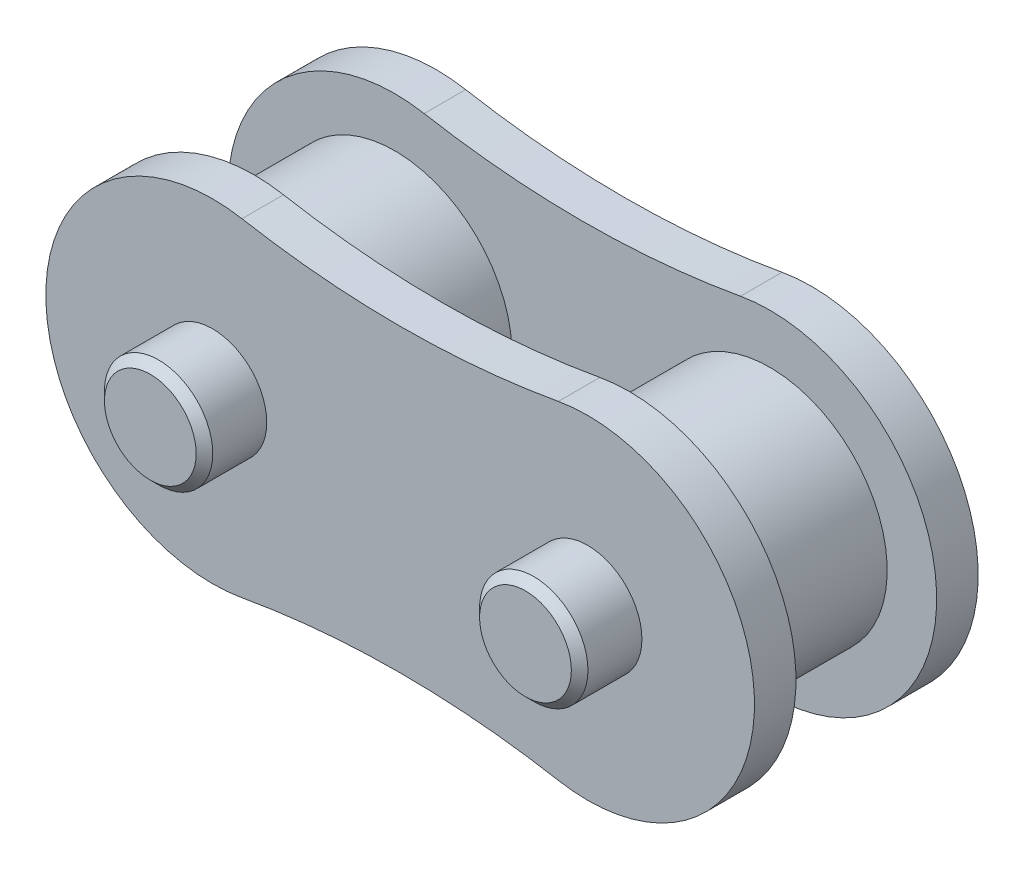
SolidWorks part; units mm, degrees
ref_plane "前视基准面" through (0, 0, 0) normal (0, 0, 1) x (1, 0, 0)
ref_plane "上视基准面" through (0, 0, 0) normal (0, 1, 0) x (1, 0, 0)
ref_plane "右视基准面" through (0, 0, 0) normal (1, 0, 0) x (0, 0, -1)
sketch "草图1" plane through (0, 0, 0) normal (0, 0, 1) x (1, 0, 0)
  line L0 (-4, 0) -> (4, 0) construction
  line L1 (0, 3.1995) -> (0, -3.1995) construction
  line L2 (4, 0) -> (8.77, 0) construction
  line L3 (8.77, 0) -> (11.77, 0) construction
  circle A0 centre (-4, 0) radius 3.555
  circle A1 centre (4, 0) radius 3.555
  circle A2 centre (0, 22.3258) radius 19.1263
  circle A3 centre (0, -22.3258) radius 19.1263
  circle A4 centre (-4, 0) radius 2.5
  circle A5 centre (4, 0) radius 2.5
  circle A6 centre (-4, 0) radius 1.155
  circle A7 centre (4, 0) radius 1.155
  dimension "h2" = 7.11
  dimension "d1" = 5
  dimension "d2" = 2.31
  dimension "p" = 8
  dimension "h3" = 6.399
  dimension "b2" = 4.77
  dimension "b1" = 3
sketch "草图2" plane through (0, 0, 0) normal (0, 0, 1) x (1, 0, 0)
  circle A0 centre (4, 0) radius 2.5 construction
  circle A1 centre (-4, 0) radius 2.5 construction
  circle A2 centre (4, 0) radius 2.5
  circle A3 centre (-4, 0) radius 2.5
extrude "拉伸1" add sketch "草图2" along normal mid plane 3
sketch "草图3" plane through (0, 0, 1.5) normal (0, 0, 1) x (1, 0, 0)
  circle A0 centre (-4, 0) radius 3.555 construction
  arc A1 (-3.3731, 3.4993) -> (-3.3731, -3.4993) centre (-4, 0) ccw
  circle A2 centre (4, 0) radius 3.555 construction
  arc A3 (3.3731, -3.4993) -> (3.3731, 3.4993) centre (4, 0) ccw
  circle A4 centre (0, 22.3258) radius 19.1263 construction
  arc A5 (-3.3731, 3.4993) -> (3.3731, 3.4993) centre (0, 22.3258) ccw
  circle A6 centre (0, -22.3258) radius 19.1263 construction
  arc A7 (3.3731, -3.4993) -> (-3.3731, -3.4993) centre (0, -22.3258) ccw
extrude "拉伸2" add sketch "草图3" along normal blind 0.885
sketch "草图4" plane through (0, 0, 2.385) normal (0, 0, 1) x (1, 0, 0)
  circle A0 centre (4, 0) radius 1.155 construction
  circle A1 centre (-4, 0) radius 1.155 construction
  circle A2 centre (4, 0) radius 1.155
  circle A3 centre (-4, 0) radius 1.155
extrude "拉伸3" add sketch "草图4" along normal blind 1.3275
chamfer "倒角1" distance 0.177 angle 45 2 edges at (5.155, 0, 3.7125) (-2.845, 0, 3.7125)
mirror "镜向1" about plane through (0, 0, 0) normal (0, 0, 1) of "拉伸2", "倒角1", "拉伸3"
equation "\"D1@拉伸2\" = (  \"b2@草图1\" - \"b1@草图1\")  / 2"
equation "\"D1@拉伸3\" = \"D1@拉伸2\" * 1.5"
equation "\"D1@倒角1\" = \"D1@拉伸2\" / 5"
equation "\"D1@拉伸1\" = \"b1@草图1\""
equation "\"h3@草图1\" = \"h2@草图1\" * 0.9"
